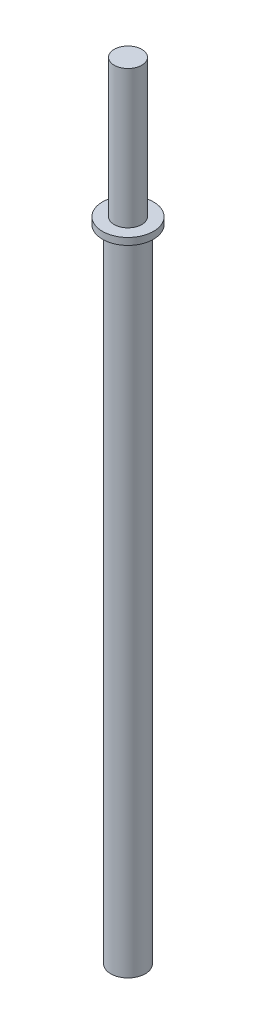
SolidWorks part; units mm, degrees
ref_plane "正面" through (0, 0, 0) normal (0, 0, 1) x (1, 0, 0)
ref_plane "平面" through (0, 0, 0) normal (0, 1, 0) x (1, 0, 0)
ref_plane "右側面" through (0, 0, 0) normal (1, 0, 0) x (0, 0, -1)
sketch "ｽｹｯﾁ1" plane through (0, 0, 0) normal (0, 0, 1) x (1, 0, 0)
  line L0 (0, 84.5019) -> (0, -29.2898)
  line L1 (0, 84.5019) -> (-2, 84.5019)
  line L2 (-2, 84.5019) -> (-2, 64.5019)
  line L3 (-2, 64.5019) -> (-3.7, 64.5019)
  line L4 (-3.7, 64.5019) -> (-3.7, 63.5019)
  line L5 (-3.7, 63.5019) -> (-2.5, 63.5019)
  line L6 (-2.5, 63.5019) -> (-2.5, -29.2898)
  line L7 (-2.5, -29.2898) -> (0, -29.2898)
  dimension "D1" = 2
  dimension "D2" = 20
  dimension "D3" = 3.7
  dimension "D4" = 2.5
  dimension "D5" = 1
revolve "回転1" add sketch "ｽｹｯﾁ1" angle 360 about L0
